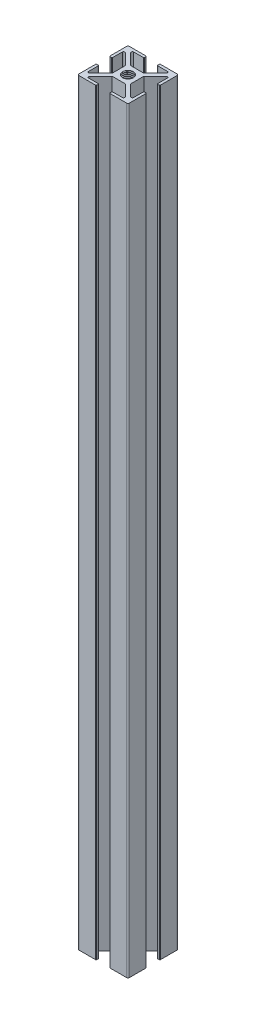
SolidWorks part; units mm, degrees
ref_plane "Front Plane" through (0, 0, 0) normal (0, 0, 1) x (1, 0, 0)
ref_plane "Top Plane" through (0, 0, 0) normal (0, 1, 0) x (1, 0, 0)
ref_plane "Right Plane" through (0, 0, 0) normal (1, 0, 0) x (0, 0, -1)
sketch "Sketch2" plane through (0, 0, 0) normal (0, 1, 0) x (1, 0, 0)
  line L12 (-10, -8.9393) -> (8.9393, 10)
  line L13 (-3.66, -3.66) -> (3.66, -3.66)
  line L26 (-3.66, -3.66) -> (-3.66, 3.66)
  line L27 (-3.66, 3.66) -> (3.66, 3.66)
  line L32 (3.66, -3.66) -> (3.66, 3.66)
  line L37 (-3.66, -3.66) -> (3.66, 3.66) construction
  line L50 (-3.66, 3.66) -> (3.66, -3.66) construction
  line L51 (-10, -8.9393) -> (-8.9393, -10)
  line L52 (8.9393, 10) -> (10, 8.9393)
  line L53 (-8.9393, -10) -> (10, 8.9393)
  line L54 (-10, -8.9393) -> (10, 8.9393) construction
  line L55 (8.9393, 10) -> (-8.9393, -10) construction
  line L56 (0, 0) -> (0, 25.4805) construction
  line L57 (10, 8.9393) -> (2.63, 8.9393)
  line L58 (-10, -8.9393) -> (-10, -10)
  line L59 (-10, -10) -> (-8.9393, -10)
  line L60 (10, 8.9393) -> (10, 10)
  line L61 (10, 10) -> (2.63, 10)
  line L62 (2.63, 8.9393) -> (2.63, 10)
  line L63 (5.995, 7.0557) -> (5.995, 8.9393)
  line L64 (10, 10) -> (10, 2.63)
  line L65 (8.9393, 10) -> (10, 10)
  line L66 (8.9393, 2.63) -> (10, 2.63)
  line L67 (8.9393, 10) -> (8.9393, 2.63)
  circle A0 centre (0, 0) radius 2.095
  point P0 (0, 0)
  dimension "D3" = 4.19
  dimension "D1" = 7.32
  dimension "D2" = 7.32
  dimension "D4" = 20
  dimension "D5" = 1.5
  dimension "D6" = 2.63
  dimension "D8" = 5.995
  dimension "D7" = 90
extrude "Boss-Extrude1" add sketch "Sketch2" along normal blind 300 contours L53 L67 L66 L64 | L67 L57 L12 L27 L32 L53 | L67 L12 L57 | L52 L67 L57 | L60 L61 L52 | L57 L67 L53 | L62 L57 L12 L61 | A0 L53 L32 L27 L12 | A0 L53 L13 L32 | A0 L12 L27 L26 | A0 L12 L26 L13 L53
fillet "Fillet1" radius 0.5 3 edges at (7.8787, 150, -8.9393) (8.9393, 150, -7.8787) (10, 150, -10)
fillet "Fillet2" radius 0.25 4 edges at (2.63, 150, -10) (2.63, 150, -8.9393) (8.9393, 150, -2.63) (10, 150, -2.63)
pattern_circular "CirPattern1" count 4 over 360 about axis through (0, 0, 0) along (0, 1, 0) of "Boss-Extrude1", "Fillet2", "Fillet1"
thread "Thread1" pitch 0.7 start angle 0, offset 0, length 10, pitch 0.7, diameter 4.19
ref_plane "Plane1" through (2.095, 0, 0) normal (0, 0, 1) x (1, 0, 0)
sketch "Thread Profile1" plane through (2.095, 0, 0) normal (0, 0, 1) x (1, 0, 0)
  line L0 (0, 0) -> (0, 0.7) construction
  line L1 (0, 0) -> (0.3789, 0.2187)
  line L2 (0.3789, 0.2187) -> (0.3789, 0.3062)
  line L3 (0.3789, 0.3062) -> (0, 0.525)
  line L4 (0.3789, 0.2625) -> (0, 0.2625) construction
  line L11 (0, 0) -> (0, 0.525)
  point P2 (0, 0)
  dimension "Pitch" = 0.7
  dimension "Profile_Angle" = 60
  dimension "Profile_Land" = 0.0875
  dimension "Profile_Height" = 0.3789
thread "Thread2" pitch 0.7 start angle 0, offset 0, length 10, pitch 0.7, diameter 4.19
ref_plane "Plane2" through (-2.095, 300, 0) normal (0, 0, 1) x (-1, 0, 0)
sketch "Thread Profile2" plane through (-2.095, 300, 0) normal (0, 0, 1) x (-1, 0, 0)
  line L0 (0, 0) -> (0, 0.7) construction
  line L1 (0, 0) -> (0.3789, 0.2187)
  line L2 (0.3789, 0.2187) -> (0.3789, 0.3062)
  line L3 (0.3789, 0.3062) -> (0, 0.525)
  line L4 (0.3789, 0.2625) -> (0, 0.2625) construction
  line L11 (0, 0) -> (0, 0.525)
  point P2 (0, 0)
  dimension "Pitch" = 0.7
  dimension "Profile_Angle" = 60
  dimension "Profile_Land" = 0.0875
  dimension "Profile_Height" = 0.3789
